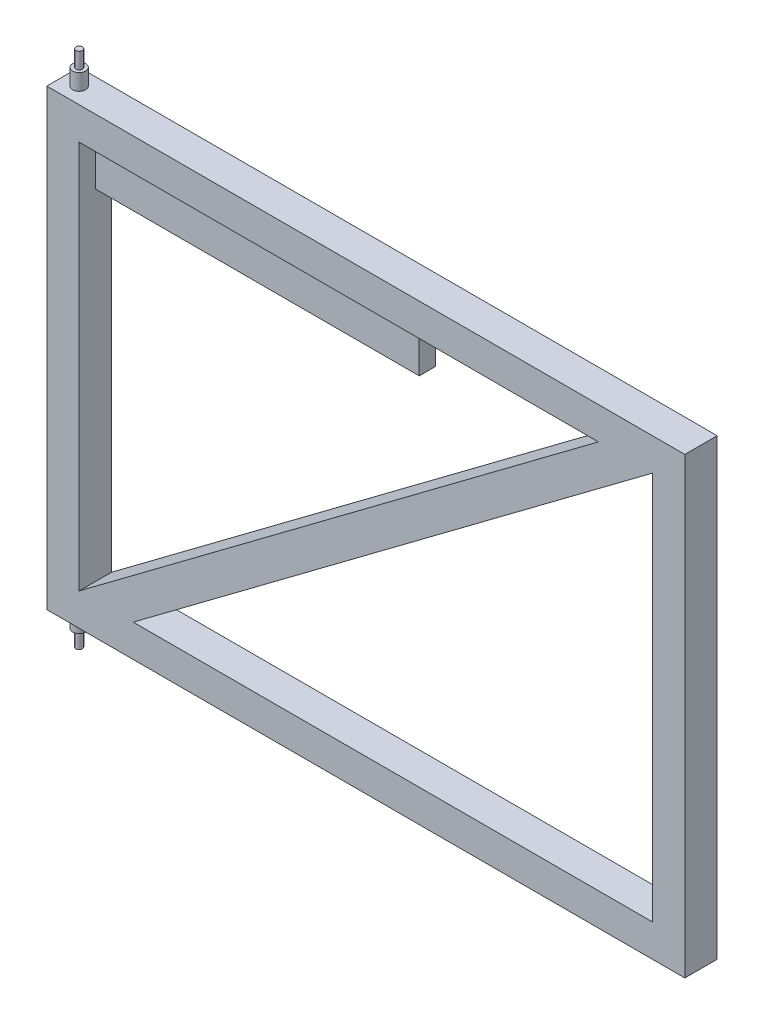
SolidWorks part; units mm, degrees
ref_plane "Face" through (0, 0, 0) normal (0, 0, 1) x (1, 0, 0)
ref_plane "Dessus" through (0, 0, 0) normal (0, 1, 0) x (1, 0, 0)
ref_plane "Droite" through (0, 0, 0) normal (1, 0, 0) x (0, 0, -1)
sketch "Esquisse1" plane through (0, 0, 0) normal (0, 0, 1) x (1, 0, 0)
  line L0 (492.5, 350) -> (-492.5, -350) construction
  line L1 (-492.5, 350) -> (492.5, 350)
  line L2 (-492.5, 350) -> (-492.5, -350)
  line L3 (-492.5, -350) -> (492.5, -350)
  line L4 (492.5, 350) -> (492.5, -350)
  line L5 (-442.5, 300) -> (359.0625, 300)
  line L6 (442.5, 300) -> (442.5, -300)
  line L8 (-442.5, 300) -> (-442.5, -300)
  line L9 (442.5, 300) -> (-359.0625, -300)
  line L10 (359.0625, 300) -> (-442.5, -300)
  line L11 (-359.0625, -300) -> (442.5, -300)
  dimension "D1" = 985
  dimension "D2" = 700
  dimension "D4" = 50
  dimension "D5" = 50
  dimension "D3" = 50
extrude "Base-Extrusion" add sketch "Esquisse1" along normal mid plane 50
sketch "Esquisse2" plane through (0, 0, 0) normal (0, 1, 0) x (1, 0, 0)
  line L0 (0, 0) -> (-467.5, 0) construction
  line L1 (-492.5, -25) -> (-492.5, 25) construction
  circle A0 centre (-467.5, 0) radius 5
  dimension "D2" = 10
  dimension "D1" = 25
extrude "Boss.-Extru.1" add sketch "Esquisse2" along normal mid plane 800
sketch "Esquisse4" plane through (0, 0, 0) normal (0, 1, 0) x (1, 0, 0)
  circle A0 centre (-467.5, 0) radius 10
  dimension "D1" = 20
extrude "Boss.-Extru.3" add sketch "Esquisse4" along normal mid plane 750
sketch "Esquisse3" plane through (0, 0, 0) normal (0, 0, 1) x (1, 0, 0)
  line L1 (-442.5, 300) -> (57.5, 300)
  line L2 (-442.5, 300) -> (-442.5, 225)
  line L3 (-442.5, 225) -> (57.5, 225)
  line L4 (57.5, 300) -> (57.5, 225)
  dimension "D1" = 75
  dimension "D2" = 500
extrude "Boss.-Extru.2" add sketch "Esquisse3" against normal blind 25
